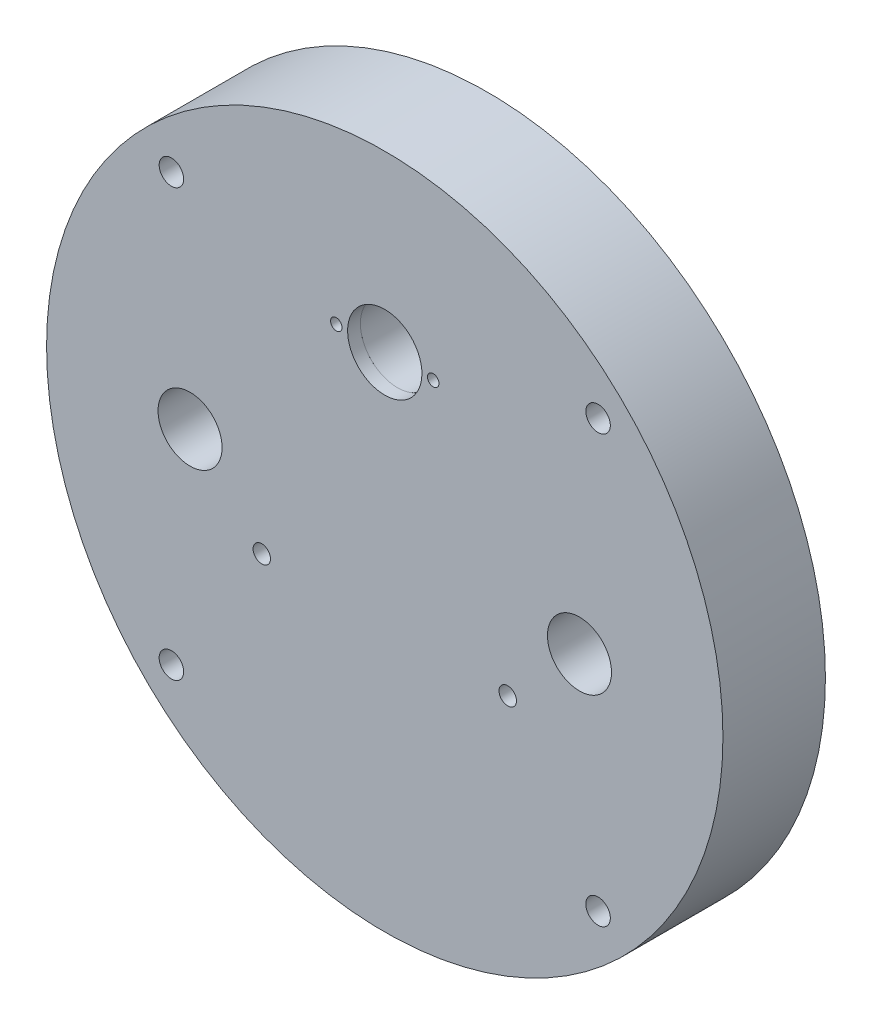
SolidWorks part; units mm, degrees
ref_plane "Front Plane" through (0, 0, 0) normal (0, 0, 1) x (1, 0, 0)
ref_plane "Top Plane" through (0, 0, 0) normal (0, 1, 0) x (1, 0, 0)
ref_plane "Right Plane" through (0, 0, 0) normal (1, 0, 0) x (0, 0, -1)
sketch "Sketch1" plane through (0, 0, 0) normal (0, 0, 1) x (1, 0, 0)
  circle A0 centre (0, 0) radius 52.3875
  dimension "D1" = 104.775
extrude "Boss-Extrude1" add sketch "Sketch1" along normal blind 15.875
hole_wizard " Tapped Hole1" positions "Sketch4" profile "Sketch5" tap size "#10-24" standard "ANSI Inch"
sketch "Sketch4" plane through (0, 0, 0) normal (0, 0, -1) x (-1, 0, 0)
  line L0 (33.0473, 33.0473) -> (0, 0) construction
  line L1 (0, 0) -> (-33.0473, 33.0473) construction
  line L4 (-33.0473, -33.0473) -> (0, 0) construction
  line L5 (0, 0) -> (33.0473, -33.0473) construction
  line L8 (8.7313, 0) -> (-8.7313, 0) construction
  circle A0 centre (0, 0) radius 46.736
  point P5 (33.0473, -33.0473)
  point P7 (-33.0473, -33.0473)
  point P9 (-33.0473, 33.0473)
  point P11 (33.0473, 33.0473)
  dimension "D1" = 93.472
  dimension "D2" = 45
sketch "Sketch5" plane through (-33.0473, -33.0473, 0) normal (1, 0, 0) x (0, 1, 0)
  line L0 (0, 0) -> (0, 15.875)
  line L1 (0, 15.875) -> (1.8986, 15.875)
  line L2 (1.8986, 15.875) -> (1.8986, 0)
  line L5 (1.8986, 0) -> (0, 0)
  line L11 (0, -6.35) -> (0, 107.95) construction
  dimension "Thread Major Dia." = 3.7973
  dimension "Thru Tap Drill Depth" = 15.875
ref_plane "Plane1" [suppressed] through (0, 0, 9.525) normal (-1, 0, 0) x (0, -1, 0)
hole_wizard "7/16-20 Tapped Hole1" positions "Sketch9" profile "Sketch8" tap size "7/16-20" standard "ANSI Inch"
sketch "Sketch9" plane through (0, 0, 15.875) normal (0, 0, 1) x (1, 0, 0)
  line L0 (30.1625, 0) -> (0, 0) construction
  line L1 (0, 0) -> (-30.1625, 0) construction
  line L4 (0, 0) -> (0, 30.1625) construction
  circle A0 centre (0, 0) radius 30.1625
  point P5 (-30.1625, 0)
  point P9 (30.1625, 0)
  dimension "D1" = 60.325
  dimension "D2" = 90
sketch "Sketch8" plane through (-30.1625, 0, 15.875) normal (1, 0, 0) x (0, -1, 0)
  line L0 (0, 0) -> (0, 15.875)
  line L1 (0, 15.875) -> (4.9606, 15.875)
  line L2 (4.9606, 15.875) -> (4.9606, 0)
  line L5 (4.9606, 0) -> (0, 0)
  line L11 (0, -6.35) -> (0, 107.95) construction
  dimension "Thru Tap Drill Dia." = 9.9212
  dimension "Thru Tap Drill Depth" = 15.875
hole_wizard "1/4-20 Tapped Hole1" positions "Sketch13" profile "Sketch12" tap size "1/4-20" standard "ANSI Inch"
sketch "Sketch13" plane through (0, 0, 0) normal (0, 0, -1) x (-1, 0, 0)
  line L0 (19.05, -31.75) -> (0, -31.75) construction
  line L1 (0, -31.75) -> (-19.05, -31.75) construction
  line L4 (0, 0) -> (0, -31.75) construction
  point P0 (-19.05, -31.75)
  point P3 (0, -31.75)
  point P6 (19.05, -31.75)
  dimension "D1" = 31.75
  dimension "D2" = 19.05
  dimension "D3" = 19.05
  dimension "D4" = 90
sketch "Sketch12" plane through (19.05, -31.75, 0) normal (1, 0, 0) x (0, 1, 0)
  line L0 (0, 0) -> (0, 14.2338)
  line L1 (0, 14.2338) -> (2.5527, 12.7)
  line L2 (2.5527, 12.7) -> (2.5527, 0)
  line L5 (2.5527, 0) -> (0, 0)
  line L10 (0, 14.2338) -> (-2.5527, 12.7) construction
  line L11 (0, -6.35) -> (0, 107.95) construction
  dimension "Tap Drill Dia." = 5.1054
  dimension "Tap Drill Depth" = 12.7
  dimension "Drill Angle" = 118
hole_wizard "#6-32 Tapped Hole1" positions "Sketch15" profile "Sketch14" tap size "#6-32" standard "ANSI Inch"
sketch "Sketch15" plane through (0, 0, 15.875) normal (0, 0, 1) x (1, 0, 0)
  line L1 (-19.05, -11.1658) -> (19.05, -11.1658) construction
  line L4 (0, 0) -> (0, -11.1658) construction
  point P0 (-19.05, -11.1658)
  point P2 (19.05, -11.1658)
  dimension "D1" = 38.1
  dimension "D2" = 11.1658
sketch "Sketch14" plane through (-19.05, -11.1658, 15.875) normal (1, 0, 0) x (0, -1, 0)
  line L0 (0, 0) -> (0, 13.5127)
  line L1 (0, 13.5127) -> (1.3525, 12.7)
  line L2 (1.3525, 12.7) -> (1.3525, 0)
  line L5 (1.3525, 0) -> (0, 0)
  line L10 (0, 13.5127) -> (-1.3526, 12.7) construction
  line L11 (0, -6.35) -> (0, 107.95) construction
  dimension "Tap Drill Dia." = 2.7051
  dimension "Tap Drill Depth" = 12.7
  dimension "Drill Angle" = 118
sketch "Sketch16" plane through (0, 0, 0) normal (0, 0, -1) x (-1, 0, 0)
  line L0 (0, 0) -> (0, 25.4) construction
  line L1 (-3.6322, 28.7782) -> (3.6322, 28.7782)
  line L2 (-4.8768, 27.5336) -> (-4.8768, 23.2664)
  line L3 (-3.6322, 22.0218) -> (3.6322, 22.0218)
  line L4 (4.8768, 27.5336) -> (4.8768, 23.2664)
  line L5 (-4.8768, 28.7782) -> (4.8768, 22.0218) construction
  line L6 (-4.8768, 22.0218) -> (4.8768, 28.7782) construction
  arc A0 (-4.8768, 23.2664) -> (-3.6322, 22.0218) centre (-3.6322, 23.2664) ccw
  arc A1 (4.8768, 23.2664) -> (3.6322, 22.0218) centre (3.6322, 23.2664) cw
  arc A2 (3.6322, 28.7782) -> (4.8768, 27.5336) centre (3.6322, 27.5336) cw
  arc A3 (-3.6322, 28.7782) -> (-4.8768, 27.5336) centre (-3.6322, 27.5336) ccw
  point P0 (0, 25.4)
  dimension "D4" = 1.2446
  dimension "D1" = 6.7564
  dimension "D2" = 9.7536
  dimension "D3" = 25.4
hole_wizard "SAE#5" positions "Sketch2" profile "Sketch3" legacy
sketch "Sketch2" plane through (37.6035, 75.915, 0) normal (0, 0, -1) x (-1, 0, 0)
  point P0 (37.6035, -50.515)
sketch "Sketch3" plane through (0, 25.4, 0) normal (1, 0, 0) x (0, 1, 0)
  line L0 (0, 0) -> (0, 13.8938)
  line L1 (0, 13.8938) -> (5.7531, 13.8938)
  line L2 (5.7531, 13.8938) -> (5.7531, 3.092)
  line L3 (6.4829, 2.3622) -> (6.985, 0)
  line L4 (6.985, 0) -> (0, 0)
  line L5 (0, -6.4453) -> (0, 42.3633) construction
  line L6 (-6.3563, 2.9576) -> (-6.985, 0) construction
  line L7 (5.7531, 3.092) -> (6.4829, 2.3622)
  dimension "Diameter" = 11.5062
  dimension "Depth" = 13.8938
  dimension "C-Sink Angle" = 24
  dimension "C-Sink Diameter" = 13.97
sketch "Sketch51" plane through (-27.3807, 11.8398, 13.8938) normal (0, 0, -1) x (-1, 0, 0)
  circle A0 centre (-27.3807, 13.5602) radius 5.7547
  dimension "D1" = 11.5094
extrude "Thru hole.172" cut sketch "Sketch51" against normal through all
other "SAE#5-Port<1>"
hole_wizard "#2-56 Tapped Hole1" positions "Sketch54" profile "Sketch55" tap size "#2-56" standard "ANSI Inch"
sketch "Sketch54" plane through (0, 0, 15.875) normal (0, 0, 1) x (1, 0, 0)
  line L0 (-7.5057, 25.4) -> (7.5057, 25.4) construction
  point P0 (-7.5057, 25.4)
  point P2 (7.5057, 25.4)
  dimension "D1" = 15.0114
sketch "Sketch55" plane through (-7.5057, 25.4, 15.875) normal (1, 0, 0) x (0, -1, 0)
  line L0 (0, 0) -> (0, 9.1702)
  line L1 (0, 9.1702) -> (0.889, 8.636)
  line L2 (0.889, 8.636) -> (0.889, 0)
  line L5 (0.889, 0) -> (0, 0)
  line L10 (0, 9.1702) -> (-0.889, 8.636) construction
  line L11 (0, -6.35) -> (0, 107.95) construction
  dimension "Tap Drill Dia." = 1.778
  dimension "Tap Drill Depth" = 8.636
  dimension "Drill Angle" = 118
